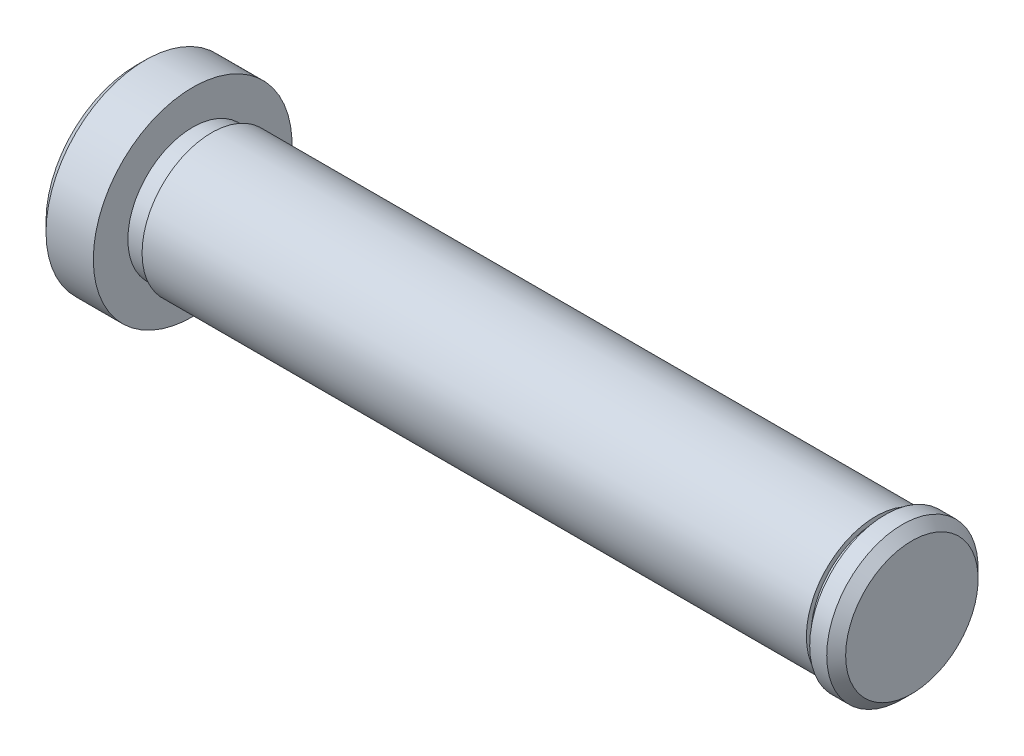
SolidWorks part; units mm, degrees
ref_plane "前视基准面" through (0, 0, 0) normal (0, 0, 1) x (1, 0, 0)
ref_plane "上视基准面" through (0, 0, 0) normal (0, 1, 0) x (1, 0, 0)
ref_plane "右视基准面" through (0, 0, 0) normal (1, 0, 0) x (0, 0, -1)
other "Configuration Table"
sketch "草图1" plane through (0, 0, 0) normal (0, 0, 1) x (1, 0, 0)
  line L0 (0, 0) -> (111.7059, 0) construction
  line L2 (0, 0) -> (6, 0)
  line L3 (0, 0) -> (0, 10.5)
  line L4 (0, 10.5) -> (6, 10.5)
  line L5 (6, 0) -> (6, 10.5)
  line L6 (6, 0) -> (8, 0)
  line L7 (6, 0) -> (6, 6.85)
  line L8 (6, 6.85) -> (8, 6.85)
  line L9 (8, 0) -> (8, 6.85)
  line L10 (8, 0) -> (78.2, 0)
  line L11 (8, 0) -> (8, 7.35)
  line L12 (8, 7.35) -> (78.2, 7.35)
  line L13 (78.2, 0) -> (78.2, 7.35)
  line L14 (78.2, 0) -> (79.2, 0)
  line L15 (78.2, 0) -> (78.2, 6.85)
  line L16 (78.2, 6.85) -> (79.2, 6.85)
  line L17 (79.2, 0) -> (79.2, 6.85)
  line L18 (79.2, 0) -> (82, 0)
  line L19 (79.2, 0) -> (79.2, 8)
  line L20 (79.2, 8) -> (82, 8)
  line L21 (82, 0) -> (82, 8)
  dimension "D1" = 6
  dimension "D2" = 10.5
  dimension "D3" = 2
  dimension "D4" = 6.85
  dimension "D5" = 70.2
  dimension "D6" = 7.35
  dimension "D7" = 1
  dimension "D8" = 8
  dimension "D9" = 82
revolve "旋转1" add sketch "草图1" angle 360 about L10
chamfer "倒角1" distance 1 2 edges at (0, 0, 10.5) (82, 0, 8)
